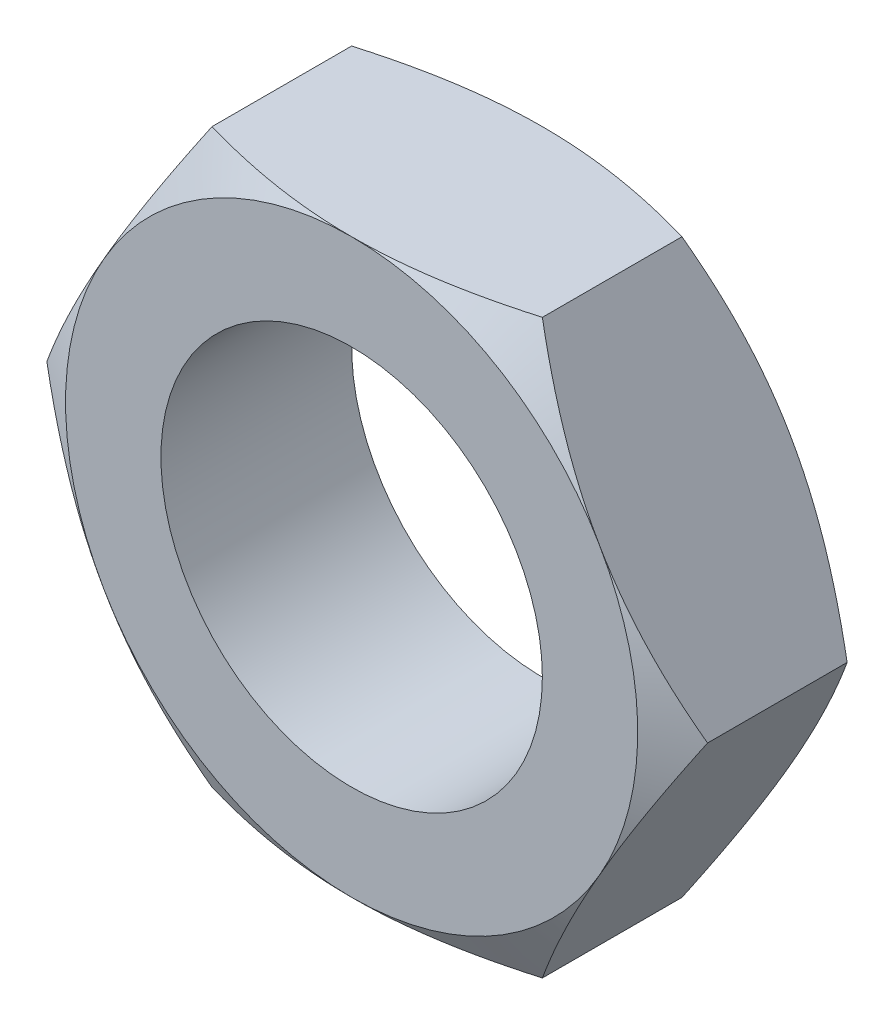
SolidWorks part; units mm, degrees
ref_plane "Front Plane" through (0, 0, 0) normal (0, 0, 1) x (1, 0, 0)
ref_plane "Top Plane" through (0, 0, 0) normal (0, 1, 0) x (1, 0, 0)
ref_plane "Right Plane" through (0, 0, 0) normal (1, 0, 0) x (0, 0, -1)
sketch "Sketch1" plane through (0, 0, 0) normal (0, 0, 1) x (1, 0, 0)
  line L1 (6.9282, 12) -> (-6.9282, 12)
  line L2 (-6.9282, 12) -> (-13.8564, 0)
  line L3 (-13.8564, 0) -> (-6.9282, -12)
  line L4 (-6.9282, -12) -> (6.9282, -12)
  line L5 (6.9282, -12) -> (13.8564, 0)
  line L6 (13.8564, 0) -> (6.9282, 12)
  circle A0 centre (0, 0) radius 12 construction
  circle A1 centre (0, 0) radius 8
  dimension "D2" = 16
  dimension "D1" = 24
extrude "Extrude1" add sketch "Sketch1" along normal mid plane 8
sketch "Sketch2" plane through (0, 0, 0) normal (1, 0, 0) x (0, 0, -1)
  line L0 (-4, 12) -> (-4, 24)
  line L1 (-4, 24) -> (2.9282, 24)
  line L2 (2.9282, 24) -> (-4, 12)
  dimension "D1" = 30
  dimension "D2" = 24
revolve "Cut-Revolve1" cut sketch "Sketch2" angle 360 about axis through (0, 0, 4) along (0, 0, -1)
mirror "Mirror1" about plane through (0, 0, 0) normal (0, 0, 1) of "Cut-Revolve1"
